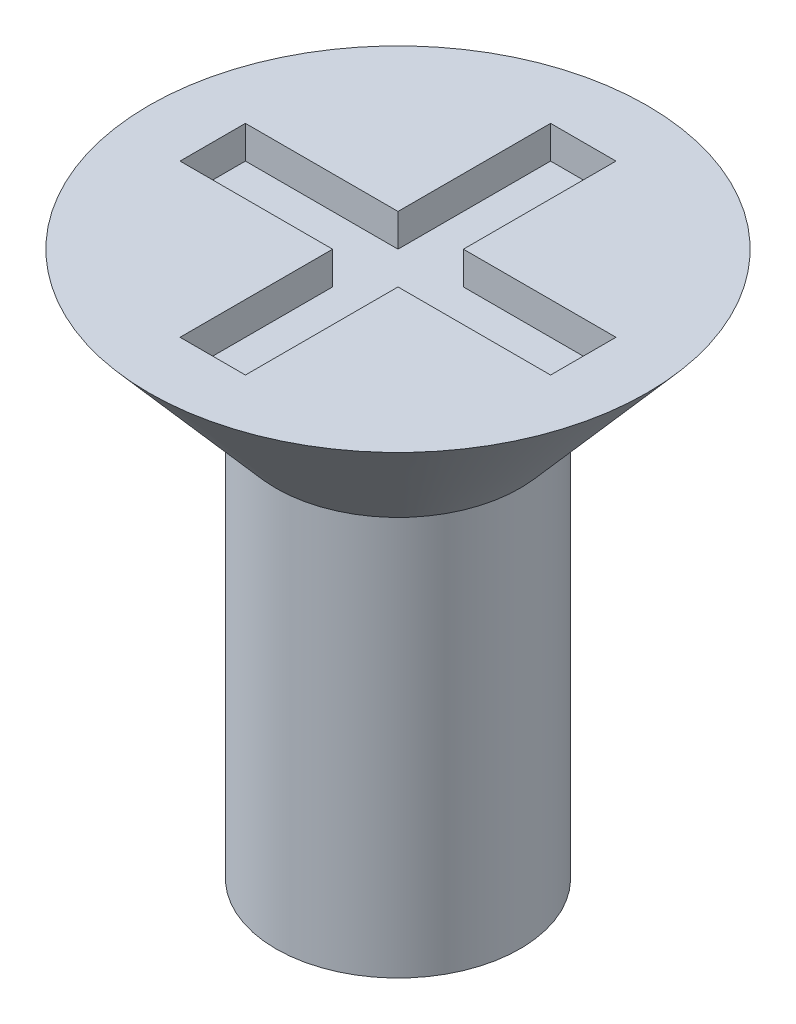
SolidWorks part; units mm, degrees
ref_plane " FRONT" through (0, 0, 0) normal (0, 0, 1) x (1, 0, 0)
ref_plane "TOP" through (0, 0, 0) normal (0, 1, 0) x (1, 0, 0)
ref_plane "SIDE" through (0, 0, 0) normal (1, 0, 0) x (0, 0, -1)
sketch "Sketch1" plane through (0, 0, 0) normal (0, 0, 1) x (1, 0, 0)
  line L0 (0, 90.8693) -> (0, -44.7514) construction
  line L1 (0, 0) -> (1.4224, 0)
  line L2 (1.4224, 0) -> (1.4224, 4.6482)
  line L3 (1.4224, 4.6482) -> (2.9018, 6.35)
  line L4 (2.9018, 6.35) -> (0, 6.35)
  line L5 (0, 0) -> (0, 6.35)
  dimension "ThreadDia" = 2.8448
  dimension "D1" = 139
  dimension "HeadHeight" = 1.7018
  dimension "TotalLength" = 6.35
revolve "FLATHEAD" add sketch "Sketch1" angle 360 about L0
sketch "Sketch2" plane through (0, 6.35, 0) normal (0, 1, 0) x (-1, 0, 0)
  line L0 (-0.381, 0) -> (0.381, 0)
  line L1 (-0.381, 0) -> (-0.381, 2.159)
  line L2 (0.381, 2.159) -> (-0.381, 2.159)
  line L3 (0.381, 2.159) -> (0.381, 0)
  line L4 (0, 50) -> (0, -50) construction
  line L5 (50, 0) -> (-50, 0) construction
extrude "PHILLIPS" cut sketch "Sketch2" against normal blind 0.381
pattern_circular "PHILLIPS PATTERN" count 4 every 90 about axis through (0, 90.8693, 0) along (0, -1, 0)
equation "\"D2@Sketch2\" = \"PhillipsWidth@Sketch2\" * .5"
